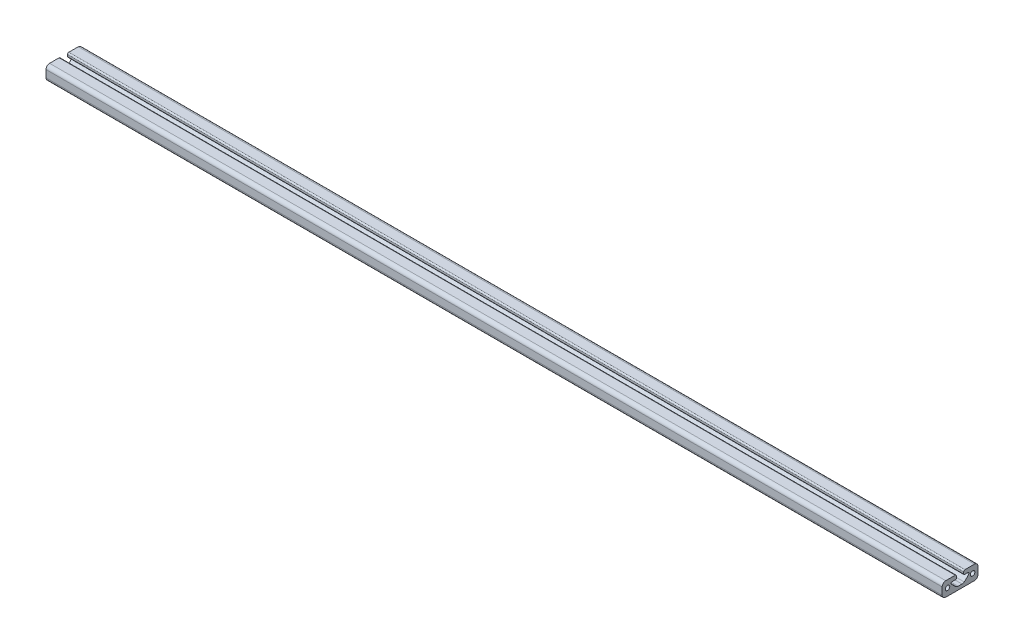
SolidWorks part; units mm, degrees
ref_plane "Ebene vorne" through (0, 0, 0) normal (0, 0, 1) x (1, 0, 0)
ref_plane "Ebene oben" through (0, 0, 0) normal (0, 1, 0) x (1, 0, 0)
ref_plane "Ebene rechts" through (0, 0, 0) normal (1, 0, 0) x (0, 0, -1)
sketch "Skizze1" plane through (0, 0, 0) normal (0, 1, 0) x (1, 0, 0)
  line L0 (0, 0) -> (1000, 0)
  dimension "D1" = 1000
other "Strukturbauteil1"
ref_plane "Ebene1" through (0, 0, 0) normal (1, 0, 0) x (0, 0, -1)
sketch "Model" plane through (0, 0, 0) normal (1, 0, 0) x (0, 0, -1)
  line L0 (-8.9161, 3.5) -> (-5, 3.5)
  line L1 (-4, 4.5) -> (-4, 6.5)
  line L2 (-5.5, 8) -> (-16, 8)
  line L3 (-20, 4) -> (-20, -4)
  line L4 (-16, -8) -> (16, -8)
  line L5 (20, -4) -> (20, 4)
  line L6 (16, 8) -> (5.5, 8)
  line L7 (4, 6.5) -> (4, 4.5)
  line L8 (5, 3.5) -> (8.9161, 3.5)
  line L9 (2.1931, -4.25) -> (-2.1931, -4.25)
  line L11 (-20, -8) -> (20, -8) construction
  line L12 (-20, -8) -> (-20, 8) construction
  line L13 (-20, 8) -> (20, 8) construction
  line L14 (20, -8) -> (20, 8) construction
  line L15 (-20, -8) -> (20, 8) construction
  line L16 (-20, 8) -> (20, -8) construction
  circle A0 centre (14, 0) radius 2.5
  circle A1 centre (-14, 0) radius 2.5
  arc A2 (-8.9161, 3.5) -> (-9.7888, 1.7733) centre (-8.9161, 2.4161) ccw
  arc A3 (-5, 3.5) -> (-4, 4.5) centre (-5, 4.5) ccw
  arc A4 (-4, 6.5) -> (-5.5, 8) centre (-5.5, 6.5) ccw
  arc A5 (-16, 8) -> (-20, 4) centre (-16, 4) ccw
  arc A6 (-20, -4) -> (-16, -8) centre (-16, -4) ccw
  arc A7 (16, -8) -> (20, -4) centre (16, -4) ccw
  arc A8 (20, 4) -> (16, 8) centre (16, 4) ccw
  arc A9 (5.5, 8) -> (4, 6.5) centre (5.5, 6.5) ccw
  arc A10 (4, 4.5) -> (5, 3.5) centre (5, 4.5) ccw
  arc A11 (9.7888, 1.7733) -> (8.9161, 3.5) centre (8.9161, 2.4161) ccw
  arc A12 (4.5803, -3.4595) -> (9.7888, 1.7733) centre (-10.34, 16.6) ccw
  arc A13 (2.1931, -4.25) -> (4.5803, -3.4595) centre (2.1931, -0.25) ccw
  arc A14 (-4.5803, -3.4595) -> (-2.1931, -4.25) centre (-2.1931, -0.25) ccw
  arc A15 (-9.7888, 1.7733) -> (-4.5803, -3.4595) centre (10.34, 16.6) ccw
  point P42 (0, 0)
  point P48 (0, 8)
  point P49 (0, 0)
